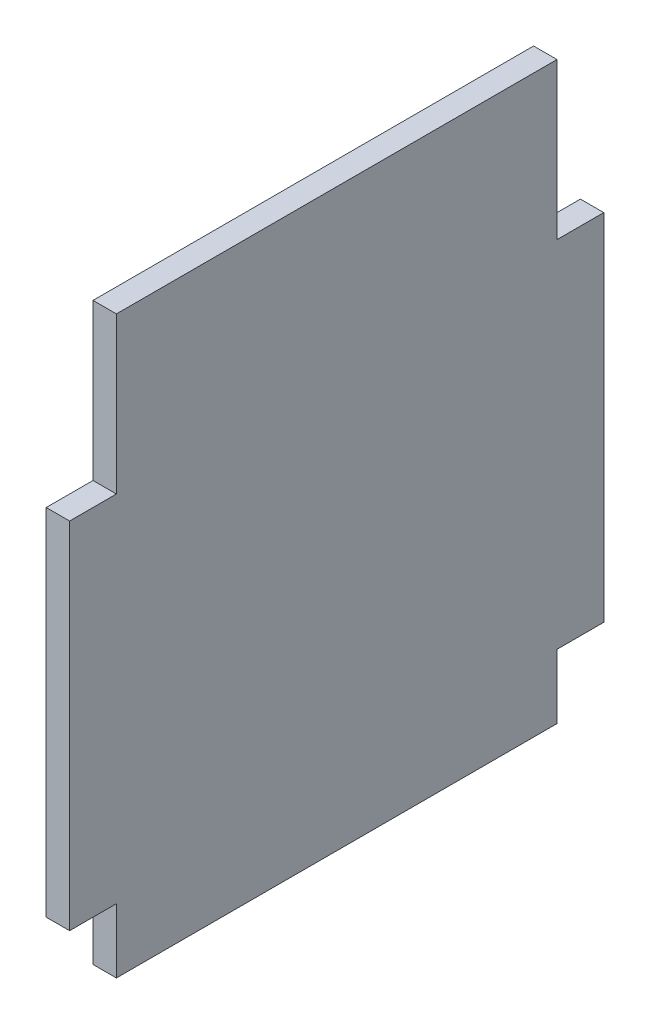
SolidWorks part; units mm, degrees
ref_plane "Plan de face" through (0, 0, 0) normal (0, 0, 1) x (1, 0, 0)
ref_plane "Plan de dessus" through (0, 0, 0) normal (0, 1, 0) x (1, 0, 0)
ref_plane "Plan de droite" through (0, 0, 0) normal (1, 0, 0) x (0, 0, -1)
sketch "Esquisse1" plane through (0, 0, 0) normal (1, 0, 0) x (0, 0, -1)
  line L1 (-68.5, 85.5) -> (68.5, 85.5)
  line L2 (-68.5, 85.5) -> (-68.5, -85.5)
  line L3 (-68.5, -85.5) -> (68.5, -85.5)
  line L4 (68.5, 85.5) -> (68.5, -85.5)
  line L5 (-68.5, 85.5) -> (68.5, -85.5) construction
  line L6 (-68.5, -85.5) -> (68.5, 85.5) construction
  point P0 (0, 0)
  dimension "D1" = 171
  dimension "D2" = 137
extrude "Boss.-Extru.1" add sketch "Esquisse1" along normal blind 6
sketch "Esquisse2" plane through (6, 0, 0) normal (1, 0, 0) x (0, 0, -1)
  line L1 (-68.5, 85.5) -> (-56.5, 85.5)
  line L2 (-68.5, 85.5) -> (-68.5, 45.5)
  line L3 (-68.5, 45.5) -> (-56.5, 45.5)
  line L4 (-56.5, 85.5) -> (-56.5, 45.5)
  dimension "D1" = 40
  dimension "D2" = 12
extrude "Enlèv. mat.-Extru.1" cut sketch "Esquisse2" against normal blind 6
mirror "Symétrie1" about plane through (0, 0, 0) normal (0, 1, 0) of "Enlèv. mat.-Extru.1"
mirror "Symétrie2" about plane through (0, 0, 0) normal (0, 0, 1) of "Symétrie1", "Enlèv. mat.-Extru.1"
sketch "Esquisse3" plane through (6, 0, 0) normal (1, 0, 0) x (0, 0, -1)
  line L0 (56.5, -45.5) -> (56.5, -85.5) construction
  line L1 (-56.5, -85.5) -> (56.5, -85.5)
  line L2 (-56.5, -85.5) -> (-56.5, -62)
  line L3 (-56.5, -62) -> (56.5, -62)
  line L4 (56.5, -85.5) -> (56.5, -62)
  dimension "D1" = 23.5
extrude "Enlèv. mat.-Extru.2" cut sketch "Esquisse3" against normal blind 10
